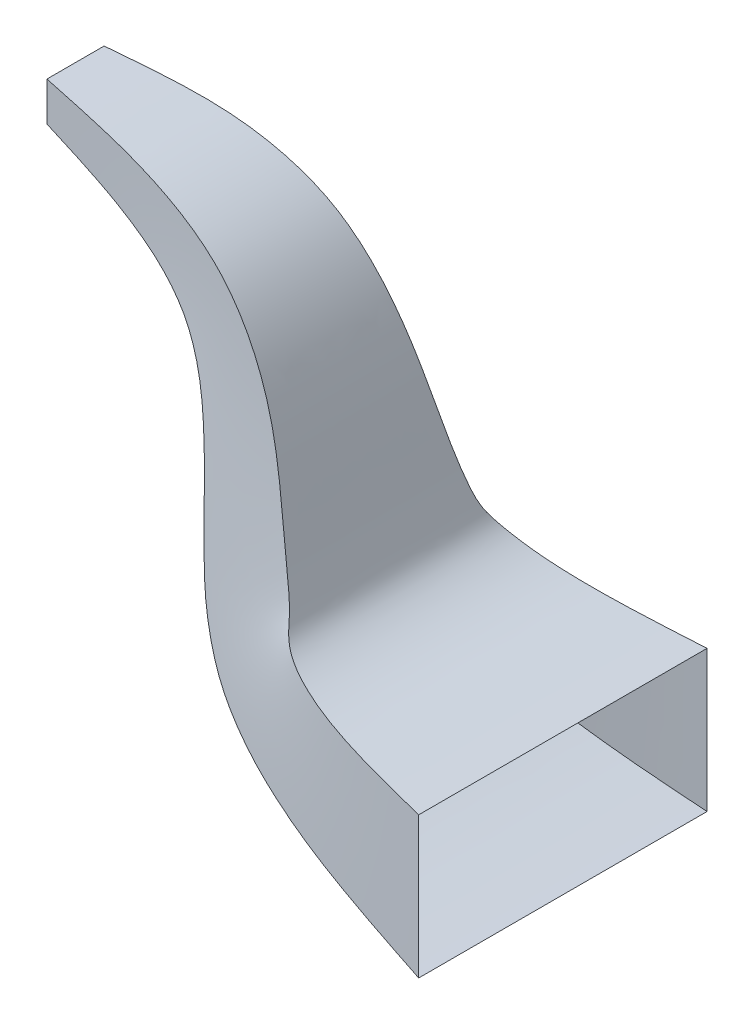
SolidWorks part; units mm, degrees
ref_plane "Front" through (0, 0, 0) normal (0, 0, 1) x (1, 0, 0)
ref_plane "Top" through (0, 0, 0) normal (0, 1, 0) x (1, 0, 0)
ref_plane "Right" through (0, 0, 0) normal (1, 0, 0) x (0, 0, -1)
sketch "Sketch2" plane through (0, 0, 0) normal (0, 0, 1) x (1, 0, 0)
  spline S0 degree 3 poles (0, 0) (20.7766, -4.3539) (69.0503, -14.47) (56.5204, -112.0987) (117.1643, -127.1179) (150, -135.25) knots 0 0 0 0 0.25732 0.597876 1 1 1 1
  dimension "D1" = 150
  dimension "D2" = 52
  dimension "D3" = 20
  dimension "D4" = 22
  dimension "D5" = 72
  dimension "D6" = 41.25
sketch "Sketch3" plane through (0, 0, 0) normal (1, 0, 0) x (0, 0, -1)
  line L1 (-8.8, 0) -> (8.8, 0)
  line L2 (-8.8, 0) -> (-8.8, 12)
  line L3 (-8.8, 12) -> (8.8, 12)
  line L4 (8.8, 0) -> (8.8, 12)
  point P4 (0, 12)
  dimension "D1" = 17.6
  dimension "D2" = 12
ref_plane "Plane1" through (150, 0, 0) normal (1, 0, 0) x (0, 0, -1)
sketch "Sketch4" plane through (150, 0, 0) normal (1, 0, 0) x (0, 0, -1)
  line L1 (-44.375, -134.8376) -> (44.375, -134.8376)
  line L2 (-44.375, -134.8376) -> (-44.375, -91.3376)
  line L3 (-44.375, -91.3376) -> (44.375, -91.3376)
  line L4 (44.375, -134.8376) -> (44.375, -91.3376)
  dimension "D1" = 88.75
  dimension "D2" = 43.5
surface "Surface-Loft1"
